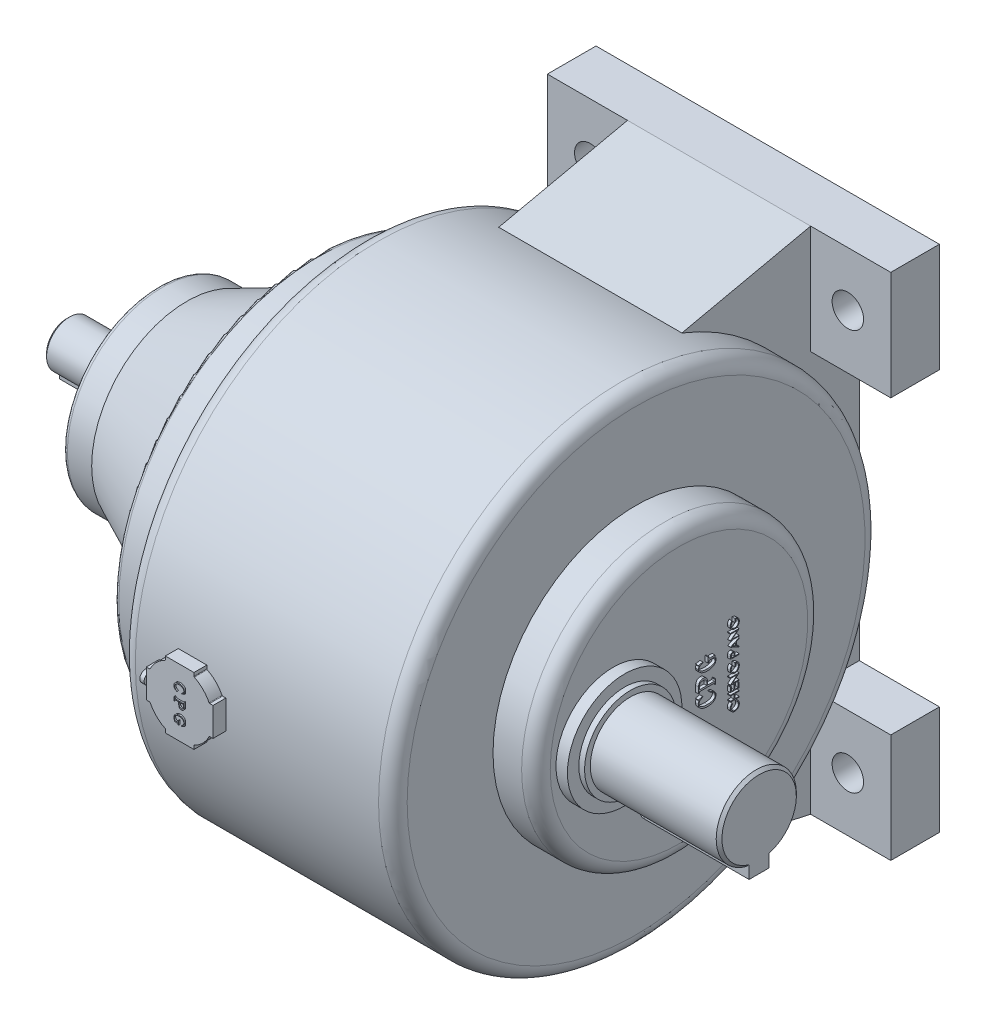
SolidWorks part; units mm, degrees
ref_plane "前视基准面" through (0, 0, 0) normal (0, 0, 1) x (1, 0, 0)
ref_plane "上视基准面" through (0, 0, 0) normal (0, 1, 0) x (1, 0, 0)
ref_plane "右视基准面" through (0, 0, 0) normal (1, 0, 0) x (0, 0, -1)
ref_plane "基准面1" through (0, 0, -116) normal (0, 0, 1) x (1, 0, 0)
sketch "草图1" plane through (0, 0, 0) normal (0, 1, 0) x (1, 0, 0)
  line L0 (0, 0) -> (33.1729, 0) construction
  line L1 (0, 0) -> (0, -14)
  line L2 (0, -14) -> (-45, -14)
  line L3 (-45, -14) -> (-45, -16)
  line L4 (-45, -16) -> (-47, -16)
  line L5 (-47, -16) -> (-47, -20)
  line L6 (-47, -20) -> (-51, -20)
  line L7 (-51, -20) -> (-51, 0)
  line L8 (-51, 0) -> (0, 0)
  dimension "D1" = 45
  dimension "D2" = 28
  dimension "D3" = 32
  dimension "D4" = 2
  dimension "D5" = 40
  dimension "D6" = 4
revolve "旋转1" add sketch "草图1" angle 360 about L0
sketch "草图2" plane through (0, 0, 0) normal (0, 1, 0) x (1, 0, 0)
  line L0 (8.0167, 23) -> (-51, 23) construction
  line L1 (-51, 23) -> (-51, -27)
  line L2 (-51, 20) -> (-51, -20) construction
  line L3 (-51, -27) -> (-66, -27)
  line L4 (-66, -27) -> (-66, -62)
  line L5 (-66, -62) -> (-161, -62)
  line L6 (-161, -62) -> (-161, 23)
  line L11 (-51, 23) -> (-161, 23)
  line L13 (-103.125, 116) -> (103.125, 116) construction
  dimension "D1" = 23
  dimension "D2" = 100
  dimension "D3" = 15
  dimension "D4" = 178
  dimension "D5" = 95
revolve "旋转2" add sketch "草图2" angle 360 about L0
sketch "草图3" plane through (0, 0, -116) normal (0, 0, 1) x (1, 0, 0)
  line L0 (0, 0) -> (40.0459, 0) construction
  line L1 (-173, -51) -> (-53, -51)
  line L2 (-173, -51) -> (-173, -89)
  line L3 (-173, -89) -> (-53, -89)
  line L4 (-53, -51) -> (-53, -89)
  line L5 (0, -14) -> (0, 14) construction
  circle A0 centre (-68, -70) radius 5.5
  circle A1 centre (-158, -70) radius 5.5
  dimension "D2" = 140
  dimension "D3" = 11
  dimension "D4" = 90
  dimension "D6" = 68
  dimension "D8" = 38
  dimension "D1" = 178
  dimension "D5" = 120
  dimension "D7" = 15
extrude "拉伸2" add sketch "草图3" along normal blind 17
mirror "镜向2" about plane through (0, 0, 0) normal (0, 1, 0)
ref_plane "基准面4" through (-113, 0, 0) normal (1, 0, 0) x (0, 0, -1)
sketch "草图4" plane through (-113, 0, 0) normal (1, 0, 0) x (0, 0, -1)
  line L0 (99, 51) -> (116, 51) construction
  line L1 (99, 51) -> (116, 51)
  line L2 (99, 89) -> (99, 51) construction
  line L3 (99, 89) -> (99, 51)
  line L4 (99, -51) -> (116, -51) construction
  line L5 (99, -51) -> (116, -51)
  line L6 (99, -89) -> (99, -51) construction
  line L7 (99, -89) -> (99, -51)
  line L8 (116, 51) -> (116, -51)
  line L9 (99, 89) -> (54, 79.1454)
  line L11 (54, -79.1454) -> (99, -89)
  arc A1 (54, -79.1454) -> (54, 79.1454) centre (23, 0) ccw
  circle A2 centre (23, 0) radius 85 construction
  dimension "D1" = 45
extrude "拉伸3" add sketch "草图4" against normal mid plane 64
sketch "草图5" plane through (0, 0, 0) normal (0, 1, 0) x (1, 0, 0)
  line L0 (0, -3.5) -> (-36.5, -3.5)
  line L1 (0, -14) -> (0, 14) construction
  line L2 (-36.5, 3.5) -> (0, 3.5)
  line L3 (0, 3.5) -> (0, -3.5)
  line L4 (31.1, -13.7955) -> (31.1, 19.6443) construction
  arc A0 (-36.5, -3.5) -> (-36.5, 3.5) centre (-36.5, 0) cw
  dimension "D2" = 40
  dimension "D1" = 7
  dimension "D3" = 31.1
extrude "拉伸4" add sketch "草图5" against normal blind 17
fillet "圆角1" radius 5 3 edges at (-161, 0, -108) (-66, 0, -108) (-51, 0, -73)
chamfer "倒角1" distance 1 angle 45 1 edges at (0, 14, 0)
sketch "草圖2"
extrude "伸長1" add sketch "草圖2" along normal blind 1
sketch "草圖3" plane through (0, 0, 0) normal (0, 1, 0) x (1, 0, 0)
  line L0 (-269.0797, 23) -> (-111.2984, 23) construction
  line L1 (-161, 23) -> (-265, 23)
  line L2 (-162.5, 92.75) -> (-177, 92.75)
  line L4 (-161, 91.25) -> (-161, 23)
  line L5 (-178.5, 76.75) -> (-223, 56.25)
  line L6 (-236.5, 31) -> (-236.5, 30.95)
  line L9 (-231.5, 56.25) -> (-223, 56.25)
  line L10 (-178.5, 91.25) -> (-178.5, 76.75)
  line L11 (-236.5, 31) -> (-264, 31)
  line L12 (-235, 30.95) -> (-236.5, 30.95)
  line L13 (-234.5, 32.75) -> (-235, 32.45)
  line L14 (-265, 23) -> (-265, 30)
  line L15 (-265, 30) -> (-264, 31)
  line L16 (-233, 32.75) -> (-234.5, 32.75)
  line L19 (-235, 32.45) -> (-235, 30.95)
  line L20 (-233, 32.75) -> (-233, 54.75)
  arc A0 (-161, 91.25) -> (-162.5, 92.75) centre (-162.5, 91.25) ccw
  arc A2 (-231.5, 56.25) -> (-233, 54.75) centre (-231.5, 54.75) ccw
  arc A3 (-177, 92.75) -> (-178.5, 91.25) centre (-177, 91.25) ccw
  dimension "D4" = 19.5
  dimension "D1" = 23
  dimension "D2" = 16
  dimension "D3" = 30
  dimension "D5" = 139.5
  dimension "D6" = 265
revolve "旋轉1" add sketch "草圖3" angle 360 about L0
sketch "草圖4" plane through (0, 0, 0) normal (0, 1, 0) x (1, 0, 0)
  line L0 (-265, 20.5) -> (-240.5, 20.5)
  line L1 (-265, 30) -> (-265, 16) construction
  line L2 (-240.5, 25.5) -> (-265, 25.5)
  line L3 (-265, 25.5) -> (-265, 20.5)
  line L4 (-280.9982, 23) -> (-227.1996, 23) construction
  line L5 (-238, 23) -> (-238, 7.6651) construction
  line L6 (-236.5, 31) -> (-264, 31) construction
  arc A0 (-240.5, 20.5) -> (-240.5, 25.5) centre (-240.5, 23) ccw
  dimension "D1" = 5
  dimension "D2" = 27
  dimension "D3" = 2.5
  dimension "D4" = 8
extrude "伸長2" add sketch "草圖4" against normal blind 10
ref_plane "平面1" through (0, 0, 66.5) normal (0, 0, 1) x (1, 0, 0)
sketch "草圖5" plane through (0, 0, 66.5) normal (0, 0, 1) x (1, 0, 0)
  line L0 (-141, 11.65) -> (-131, 11.65)
  line L1 (-141, 11.65) -> (-141, 10.5119)
  line L2 (-131, 11.65) -> (-131, 10.5119)
  line L3 (-141, -10.5119) -> (-141, -11.65)
  line L4 (-131, -10.5119) -> (-131, -11.65)
  line L5 (-147.65, 5) -> (-146.5119, 5)
  line L6 (-147.65, -5) -> (-146.5119, -5)
  line L7 (-147.65, -5) -> (-147.65, 5)
  line L8 (-141, -11.65) -> (-141, -10.5119)
  line L9 (-131, -11.65) -> (-131, -10.5119)
  line L10 (-131, -11.65) -> (-141, -11.65)
  line L11 (-124.35, -5) -> (-125.4881, -5)
  line L12 (-124.35, 5) -> (-125.4881, 5)
  line L13 (-124.35, 5) -> (-124.35, -5)
  arc A0 (-141.1383, 10.2882) -> (-146.2882, 5.1383) centre (-136, 0) ccw
  arc A1 (-141.1383, 10.2882) -> (-141, 10.5119) centre (-141.25, 10.5119) ccw
  arc A2 (-131, 10.5119) -> (-130.8617, 10.2882) centre (-130.75, 10.5119) ccw
  arc A3 (-146.5119, 5) -> (-146.2882, 5.1383) centre (-146.5119, 5.25) ccw
  arc A4 (-146.2882, -5.1383) -> (-146.5119, -5) centre (-146.5119, -5.25) ccw
  arc A5 (-141, -10.5119) -> (-141.1383, -10.2882) centre (-141.25, -10.5119) ccw
  arc A6 (-130.8617, -10.2882) -> (-131, -10.5119) centre (-130.75, -10.5119) ccw
  arc A7 (-125.4881, -5) -> (-125.7118, -5.1383) centre (-125.4881, -5.25) ccw
  arc A8 (-125.7118, 5.1383) -> (-125.4881, 5) centre (-125.4881, 5.25) ccw
  arc A9 (-125.7118, 5.1383) -> (-130.8617, 10.2882) centre (-136, 0) ccw
  arc A10 (-146.2882, -5.1383) -> (-141.1383, -10.2882) centre (-136, 0) ccw
  arc A11 (-130.8617, -10.2882) -> (-125.7118, -5.1383) centre (-136, 0) ccw
  dimension "D1" = 11.5
extrude "伸長3" add sketch "草圖5" against normal blind 4.5 separate body contours A6 A11 A7 L11 L13 L12 A8 A9 A2 L2 L0 L1 A1 A0 A3 L5 L7 L6 A4 A10 A5 L3 L10 L4
sketch "草圖6"
extrude "伸長4" add sketch "草圖6" along normal blind 0.5
sketch "草圖7" plane through (0, 0, 0) normal (0, 1, 0) x (1, 0, 0)
  line L0 (-150.1623, -64.25) -> (-142.1623, -64.25)
  line L1 (-150.1623, -64.25) -> (-150.1623, -62.25)
  line L2 (-148.6623, -63) -> (-148.6623, -62.25)
  line L13 (-146.6623, -63) -> (-142.1623, -63.25)
  line L15 (-148.6623, -63) -> (-146.6623, -63)
  line L23 (-150.1623, -62.25) -> (-148.6623, -62.25)
  line L24 (-146.6623, -64.25) -> (-146.6623, -63)
  line L25 (-142.1623, -64.25) -> (-142.1623, -63.25)
revolve "旋轉2" add sketch "草圖7" angle 360 about L0
equation "\"D7@草图3\" =  ( \"D5@草图3\"-\"D4@草图3\"  )  / 2"
equation "\"D8@草图3\" =  \"D1@草图3\"-\"D2@草图3\""
equation "\"D1@拉伸4\" =\"D3@草图5\"-\"D2@草图1\"/2"
equation "\"D3@草图1\" = \"D2@草图1\"+4"
equation "\"D5@草图2\" = \"D4@草图3\"+5"
equation "\"D1@基准面4\" =\"D5@草图3\"/2"
equation "\"D1@拉伸3\" = \"D4@草图3\"-\"D3@草图3\" - 15"
